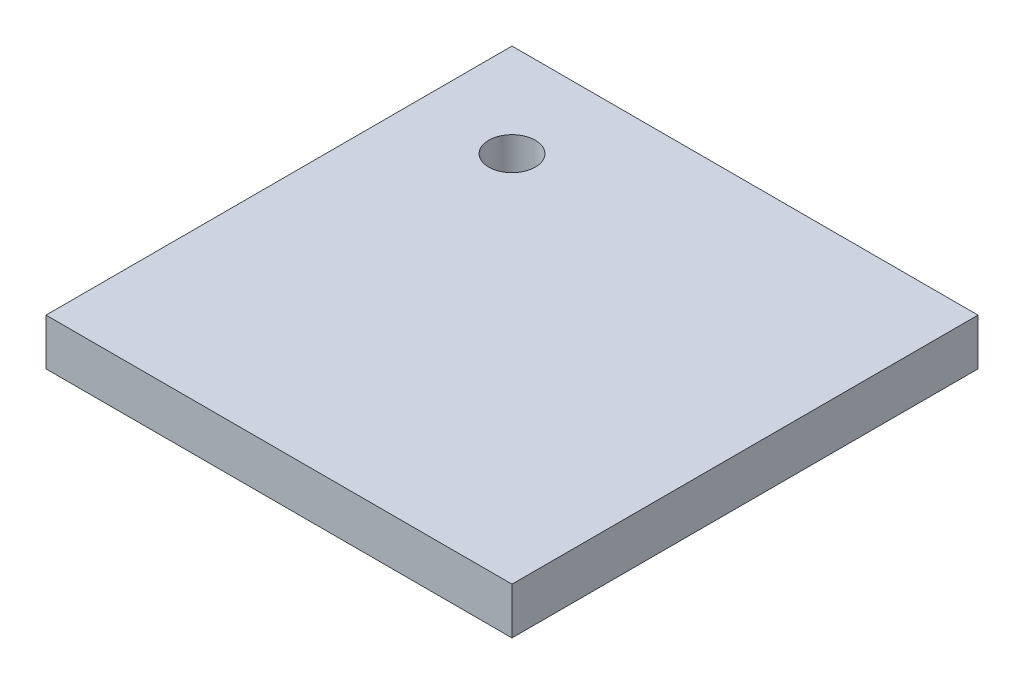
SolidWorks part; units mm, degrees
ref_plane "Front Plane" through (0, 0, 0) normal (0, 0, 1) x (1, 0, 0)
ref_plane "Top Plane" through (0, 0, 0) normal (0, 1, 0) x (1, 0, 0)
ref_plane "Right Plane" through (0, 0, 0) normal (1, 0, 0) x (0, 0, -1)
sketch "Sketch1" plane through (0, 0, 0) normal (0, 1, 0) x (1, 0, 0)
  line L1 (0, 0) -> (100, 0)
  line L2 (0, 0) -> (0, 100)
  line L3 (0, 100) -> (100, 100)
  line L4 (100, 0) -> (100, 100)
  dimension "D1" = 100
  dimension "D2" = 100
extrude "Extrude1" add sketch "Sketch1" along normal blind 10
hole_wizard " (10) Diameter Hole1" positions "3DSketch1" profile "Sketch2" hole size "Ø10.0" standard "Ansi Metric"
sketch3d "3DSketch1"
  line L0 (0, 10, -100) -> (0, 10, 0) construction
  line L1 (100, 10, -100) -> (0, 10, -100) construction
  point P0 (20, 10, -80)
  dimension "D1" = 20
  dimension "D2" = 20
sketch "Sketch2" plane through (20, 10, -80) normal (1, 0, 0) x (0, 0, 1)
  line L0 (0, 0) -> (0, 13.0043)
  line L1 (0, 13.0043) -> (5, 10)
  line L2 (5, 10) -> (5, 0)
  line L5 (5, 0) -> (0, 0)
  line L10 (0, 13.0043) -> (-5, 10) construction
  line L11 (0, -6.35) -> (0, 107.95) construction
  dimension "Hole Dia." = 10
  dimension "Hole Depth" = 10
  dimension "Drill Angle" = 118
